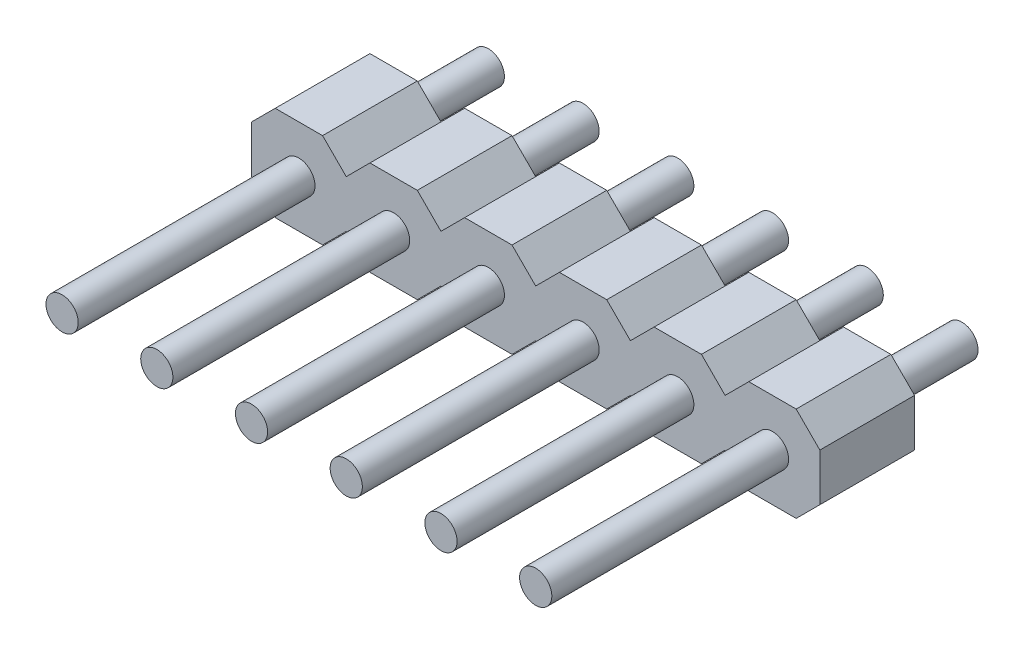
SolidWorks part; units mm, degrees
ref_plane "Front Plane" through (0, 0, 0) normal (0, 0, 1) x (1, 0, 0)
ref_plane "Top Plane" through (0, 0, 0) normal (0, 1, 0) x (1, 0, 0)
ref_plane "Right Plane" through (0, 0, 0) normal (1, 0, 0) x (0, 0, -1)
sketch "Sketch1" plane through (0, 0, 0) normal (0, 0, 1) x (1, 0, 0)
  line L0 (13.97, -0.635) -> (13.335, -1.27)
  line L1 (-0.635, 1.27) -> (0.635, 1.27)
  line L2 (-1.27, 0.635) -> (-1.27, -0.635)
  line L3 (-1.27, -0.635) -> (-0.635, -1.27)
  line L4 (13.335, 1.27) -> (13.97, 0.635)
  line L5 (-0.635, 1.27) -> (-1.27, 0.635)
  line L6 (0.635, 1.27) -> (1.27, 0.635)
  line L7 (1.27, 0.635) -> (1.905, 1.27)
  line L8 (1.905, 1.27) -> (3.175, 1.27)
  line L9 (3.175, 1.27) -> (3.81, 0.635)
  line L10 (3.81, 0.635) -> (4.445, 1.27)
  line L11 (4.445, 1.27) -> (5.715, 1.27)
  line L12 (5.715, 1.27) -> (6.35, 0.635)
  line L13 (6.35, 0.635) -> (6.985, 1.27)
  line L14 (6.985, 1.27) -> (8.255, 1.27)
  line L15 (8.255, 1.27) -> (8.89, 0.635)
  line L16 (8.89, 0.635) -> (9.525, 1.27)
  line L17 (9.525, 1.27) -> (10.795, 1.27)
  line L18 (10.795, 1.27) -> (11.43, 0.635)
  line L19 (11.43, 0.635) -> (12.065, 1.27)
  line L20 (12.065, 1.27) -> (13.335, 1.27)
  line L21 (13.97, 0.635) -> (13.97, -0.635)
  line L22 (13.335, -1.27) -> (12.065, -1.27)
  line L23 (12.065, -1.27) -> (11.43, -0.635)
  line L24 (11.43, -0.635) -> (10.795, -1.27)
  line L25 (10.795, -1.27) -> (9.525, -1.27)
  line L26 (9.525, -1.27) -> (8.89, -0.635)
  line L27 (8.89, -0.635) -> (8.255, -1.27)
  line L28 (8.255, -1.27) -> (6.985, -1.27)
  line L29 (6.985, -1.27) -> (6.35, -0.635)
  line L30 (6.35, -0.635) -> (5.715, -1.27)
  line L31 (5.715, -1.27) -> (4.445, -1.27)
  line L32 (4.445, -1.27) -> (3.81, -0.635)
  line L33 (3.81, -0.635) -> (3.175, -1.27)
  line L34 (3.175, -1.27) -> (1.905, -1.27)
  line L35 (1.905, -1.27) -> (1.27, -0.635)
  line L36 (1.27, -0.635) -> (0.635, -1.27)
  line L37 (0.635, -1.27) -> (-0.635, -1.27)
extrude "Boss-Extrude1" add sketch "Sketch1" along normal blind 2.54
sketch "Sketch6" plane through (0, 0, 0) normal (0, 0, -1) x (-1, 0, 0)
  circle A0 centre (0, 0) radius 0.4318
  circle A2 centre (-2.54, 0) radius 0.4318
  circle A3 centre (-5.08, 0) radius 0.4318
  circle A4 centre (-7.62, 0) radius 0.4318
  circle A5 centre (-10.16, 0) radius 0.4318
  circle A6 centre (-12.7, 0) radius 0.4318
extrude "Boss-Extrude4" add sketch "Sketch6" along normal blind 2.54 and the other way blind 8.89 separate body
